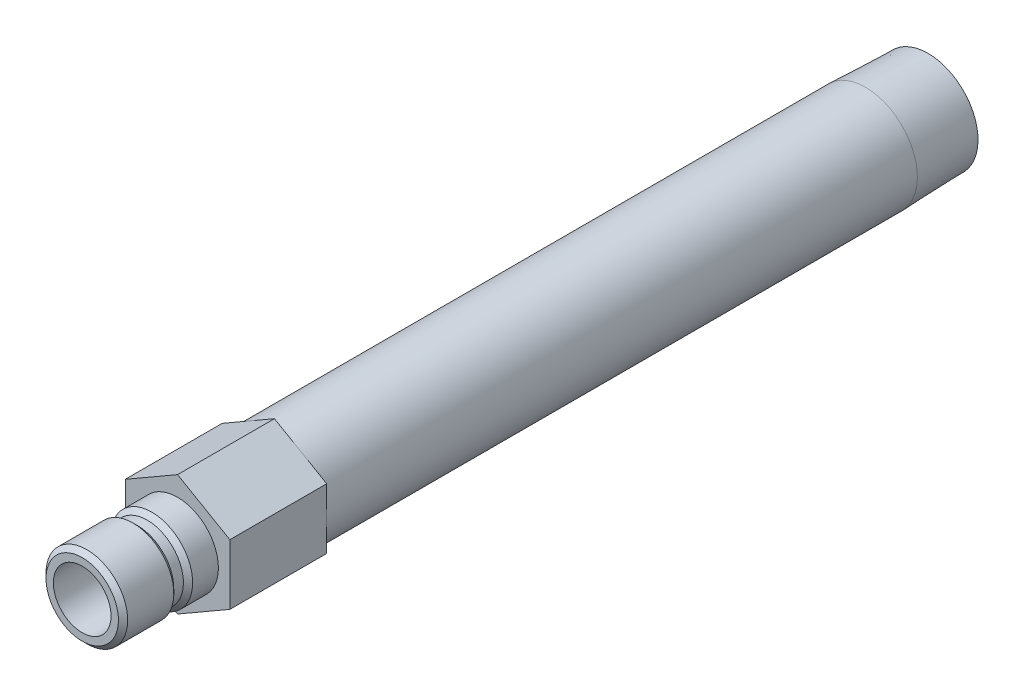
SolidWorks part; units mm, degrees
ref_plane "Front Plane" through (0, 0, 0) normal (0, 0, 1) x (1, 0, 0)
ref_plane "Top Plane" through (0, 0, 0) normal (0, 1, 0) x (1, 0, 0)
ref_plane "Right Plane" through (0, 0, 0) normal (1, 0, 0) x (0, 0, -1)
sketch "Sketch1" plane through (0, 0, 0) normal (1, 0, 0) x (0, 0, -1)
  line L0 (0, 0) -> (-18.923, 0) construction
  line L1 (-15.748, 4.7625) -> (-15.748, 5.9817)
  line L2 (-6.604, 5.9817) -> (-6.604, 0) construction
  line L3 (-14.986, 6.7437) -> (-7.366, 6.7437)
  line L4 (0, 8.5725) -> (0, 0) construction
  line L5 (-6.604, 5.9817) -> (-5.0165, 5.9817)
  line L6 (-4.2545, 6.7437) -> (0, 6.7437)
  line L7 (0, 6.7437) -> (0, 8.5725)
  line L8 (-6.604, 5.9817) -> (-7.366, 6.7437)
  line L9 (-5.0165, 5.9817) -> (-4.2545, 6.7437)
  line L10 (-15.748, 5.9817) -> (-14.986, 6.7437)
  line L11 (-15.748, 4.7625) -> (16.002, 4.7625)
  line L12 (0, 8.5725) -> (113.6142, 8.5725)
  line L13 (113.6142, 8.5725) -> (123.952, 8.2494)
  line L14 (123.952, 8.2494) -> (123.952, 6.2611)
  line L15 (0, 6.7437) -> (16.002, 6.7437) construction
  line L16 (16.002, 6.7437) -> (16.002, 0) construction
  line L17 (16.002, 0) -> (0, 0) construction
  line L18 (16.002, 4.7625) -> (16.002, 6.2611)
  line L19 (16.002, 6.2611) -> (123.952, 6.2611)
  dimension "D1" = 15.748
  dimension "D2" = 1.5875
  dimension "D3" = 0.762
  dimension "D4" = 45
  dimension "D5" = 9.144
  dimension "D6" = 45
  dimension "D7" = 1.79
  dimension "D8" = 10.3378
  dimension "D9" = 139.7
  dimension "D10" = 3.175
  dimension "D11" = 9.525
  dimension "D12" = 17.145
  dimension "D13" = 31.75
  dimension "D14" = 13.4874
  dimension "D15" = 12.5222
revolve "Revolve1" add sketch "Sketch1" angle 360 about L0
sketch "Sketch2" plane through (0, 0, 0) normal (0, 0, 1) x (1, 0, 0)
  line L1 (-8.636, 4.986) -> (-8.636, -4.986)
  line L2 (-8.636, -4.986) -> (0, -9.972)
  line L3 (0, -9.972) -> (8.636, -4.986)
  line L4 (8.636, -4.986) -> (8.636, 4.986)
  line L5 (8.636, 4.986) -> (0, 9.972)
  line L6 (0, 9.972) -> (-8.636, 4.986)
  circle A0 centre (0, 0) radius 8.636 construction
  circle A1 centre (0, 0) radius 4.7625 construction
  circle A2 centre (0, 0) radius 4.7625
  dimension "D1" = 17.272
extrude "Boss-Extrude1" add sketch "Sketch2" against normal up to vertex (16.002 mm away) from vertex at 0
